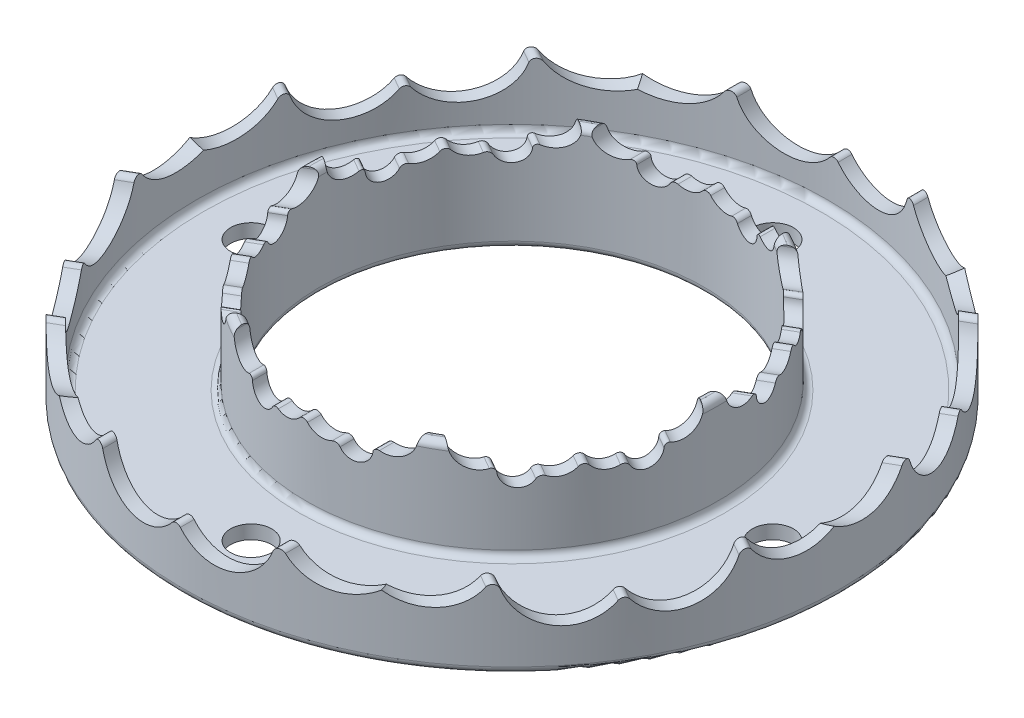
SolidWorks part; units mm, degrees
ref_plane "Plan de face" through (0, 0, 0) normal (0, 0, 1) x (1, 0, 0)
ref_plane "Plan de dessus" through (0, 0, 0) normal (0, 1, 0) x (1, 0, 0)
ref_plane "Plan de droite" through (0, 0, 0) normal (1, 0, 0) x (0, 0, -1)
sketch "Esquisse1" plane through (0, 0, 0) normal (0, 0, 1) x (1, 0, 0)
  line L0 (-120, 22.3631) -> (-120, -17.6369)
  line L1 (-120, -17.6369) -> (-70, -17.6369)
  line L2 (-70, -17.6369) -> (-70, 22.3631)
  line L3 (-70, 22.3631) -> (-75, 22.3631)
  line L4 (-75, 22.3631) -> (-75, -12.6369)
  line L5 (-75, -12.6369) -> (-115, -12.6369)
  line L6 (-115, -12.6369) -> (-115, 22.3631)
  line L7 (-115, 22.3631) -> (-120, 22.3631)
  line L8 (0, 37.9328) -> (0, -26.6242) construction
  line L9 (-120.6286, 0) -> (-57.3375, 0) construction
  dimension "D1" = 40
  dimension "D2" = 50
  dimension "D3" = 5
  dimension "D4" = 5
  dimension "D5" = 70
revolve "Révolution1" add sketch "Esquisse1" angle 360 about L8
fillet "Congé1" radius 2.5 8 edges at (-70, -17.6369, 0) (-120, -17.6369, 0) (-75, 22.3631, 0) (-70, 22.3631, 0) (-120, 22.3631, 0) (-115, 22.3631, 0) (-75, -12.6369, 0) (-115, -12.6369, 0)
sketch "Esquisse2" plane through (0, -12.6369, 0) normal (0, 1, 0) x (1, 0, 0)
  line L0 (0, 60.1566) -> (0, -68.0202) construction
  circle A0 centre (-95, 0) radius 7.5
  dimension "D1" = 15
  dimension "D2" = 95
extrude "Enlèv. mat.-Extru.1" cut sketch "Esquisse2" against normal blind 10
pattern_circular "Répétition circulaire1" count 4 every 90 about axis through (0, 0, 0) along (0, 1, 0) of "Enlèv. mat.-Extru.1"
ref_plane "Plan1" through (0, 0, 120) normal (0, 0, 1) x (1, 0, 0)
sketch "Esquisse3" plane through (0, 0, 120) normal (0, 0, 1) x (1, 0, 0)
  line L0 (120, -15.1369) -> (-120, -15.1369) construction
  line L1 (-69.4492, 19.8631) -> (-69.4492, 43.0641)
  line L2 (-69.4492, 43.0641) -> (65.1124, 43.0641)
  line L3 (65.1124, 43.0641) -> (64.8315, 19.6532)
  arc A0 (-34.6287, 17.3631) -> (-2.3082, 5.8493) centre (-17.3082, 14.8631) ccw
  arc A1 (-2.3082, 5.8493) -> (30.0123, 17.3631) centre (12.6918, 14.8631) ccw
  arc A2 (-69.4492, 19.8631) -> (-34.6287, 17.3631) centre (-51.9492, 19.8631) ccw
  arc A3 (30.0123, 17.3631) -> (64.8315, 19.6532) centre (47.3328, 19.8631) ccw
  dimension "D1" = 35
  dimension "D2" = 30
  dimension "D3" = 35
extrude "Enlèv. mat.-Extru.2" cut sketch "Esquisse3" against normal blind 30
fillet "Congé3" radius 2 3 edges at (30.0123, 17.3631, 113.6005) (-2.3082, 5.8493, 117.4773) (-34.6287, 17.3631, 112.2787)
pattern_circular "Répétition circulaire7" count 6 every 60 about axis through (0, 37.9328, 0) along (0, 1, 0) of "Congé3", "Enlèv. mat.-Extru.2"
ref_plane "Plan2" through (0, 0, 75) normal (0, 0, 1) x (1, 0, 0)
sketch "Esquisse4" plane through (0, 0, 75) normal (0, 0, 1) x (1, 0, 0)
  line L0 (120, -15.1369) -> (-120, -15.1369) construction
  line L1 (-34.888, 21.7872) -> (-34.888, 41.6815)
  line L2 (32.9684, 21.8503) -> (32.9684, 41.6815)
  line L3 (32.9684, 41.6815) -> (-34.888, 41.6815)
  arc A0 (-12.7611, 14.2478) -> (-0.9597, 17.3168) centre (-7.9597, 20.0094) ccw
  arc A1 (-0.9597, 17.3168) -> (10.8418, 14.2478) centre (6.0403, 20.0094) ccw
  arc A2 (-23.1795, 14.4669) -> (-12.7611, 14.2478) centre (-17.9597, 14.8631) ccw
  arc A3 (10.8418, 14.2478) -> (21.2601, 14.4669) centre (16.0403, 14.8631) ccw
  arc A4 (-34.888, 21.7872) -> (-24.9976, 15.524) centre (-27.9597, 21.7872) ccw
  arc A5 (23.0783, 15.524) -> (32.9684, 21.8503) centre (26.0403, 21.7872) ccw
  arc A6 (-23.1795, 14.4669) -> (-24.9976, 15.524) centre (-24.452, 14.3702) ccw
  arc A7 (23.0783, 15.524) -> (21.2601, 14.4669) centre (22.5327, 14.3702) ccw
  dimension "D1" = 15
  dimension "D2" = 14
  dimension "D3" = 10
  dimension "D4" = 30
  dimension "D5" = 10
extrude "Enlèv. mat.-Extru.3" cut sketch "Esquisse4" against normal blind 20
fillet "Congé5" radius 2 3 edges at (10.8418, 14.2478, 71.6838) (-0.9597, 17.3168, 72.4936) (-12.7611, 14.2478, 71.3667)
pattern_circular "Répétition circulaire9" count 6 every 60 about axis through (0, 0, 0) along (0, 1, 0) of "Congé5", "Enlèv. mat.-Extru.3"
